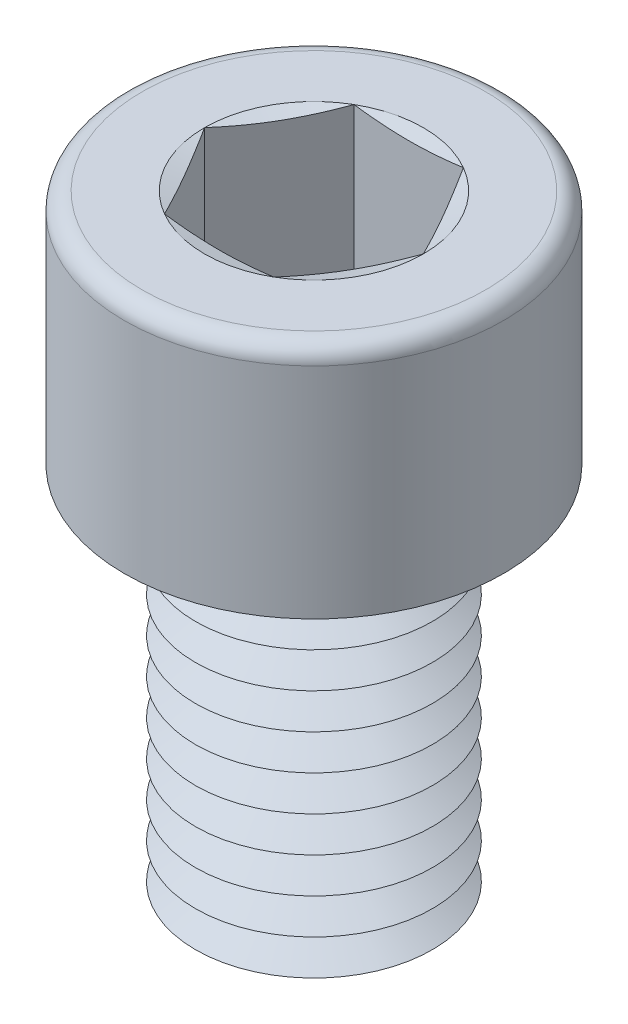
SolidWorks part; units mm, degrees
ref_plane "Front Plane" through (0, 0, 0) normal (0, 0, 1) x (1, 0, 0)
ref_plane "Top Plane" through (0, 0, 0) normal (0, 1, 0) x (1, 0, 0)
ref_plane "Right Plane" through (0, 0, 0) normal (1, 0, 0) x (0, 0, -1)
sketch "Sketch1" plane through (0, 0, 0) normal (0, 1, 0) x (1, 0, 0)
  circle A0 centre (0, 0) radius 5
  dimension "D1" = 10
extrude "Extrude1" add sketch "Sketch1" along normal blind 16
sketch "Sketch2" plane through (0, 16, 0) normal (0, 1, 0) x (1, 0, 0)
  circle A0 centre (0, 0) radius 8
  dimension "D1" = 16
extrude "Extrude2" add sketch "Sketch2" along normal blind 10
sketch "Sketch3" plane through (0, 26, 0) normal (0, 1, 0) x (1, 0, 0)
  line L1 (2.3094, 4) -> (-2.3094, 4)
  line L2 (-2.3094, 4) -> (-4.6188, 0)
  line L3 (-4.6188, 0) -> (-2.3094, -4)
  line L4 (-2.3094, -4) -> (2.3094, -4)
  line L5 (2.3094, -4) -> (4.6188, 0)
  line L6 (4.6188, 0) -> (2.3094, 4)
  circle A0 centre (0, 0) radius 4 construction
  dimension "D1" = 8
extrude "Extrude3" cut sketch "Sketch3" against normal blind 8
fillet "Fillet1" radius 0.75 1 edges at (0, 26, 8)
sketch "Sketch4" plane through (0, 0, 0) normal (1, 0, 0) x (0, 0, -1)
  line L0 (-4, 18) -> (0, 18)
  line L1 (0, 18) -> (0, 15.6906)
  line L2 (0, 15.6906) -> (-4, 18)
  dimension "D1" = 30
revolve "Cut-Revolve1" cut sketch "Sketch4" angle 360 about L1
sketch "Sketch5" plane through (0, 0, 0) normal (0, 0, 1) x (1, 0, 0)
  line L0 (-5, 0.75) -> (-5, -0.75)
  line L1 (-5, 16) -> (-5, 0) construction
  line L2 (-5, -0.75) -> (-3.701, 0)
  line L3 (-5, 0) -> (5, 0) construction
  line L4 (-3.701, 0) -> (-5, 0.75)
  dimension "D1" = 1.5
revolve "Cut-Revolve2" cut sketch "Sketch5" angle 360 about axis through (0, 16, 0) along (0, -1, 0)
pattern_linear "LPattern1" count 11 spacing 1.5 along (0, 1, 0) of "Cut-Revolve2"
sketch "Sketch6" plane through (0, 26, 0) normal (0, 1, 0) x (1, 0, 0)
  circle A0 centre (0, 0) radius 4.6188
extrude "Extrude4" cut sketch "Sketch6" against normal through all draft 75
